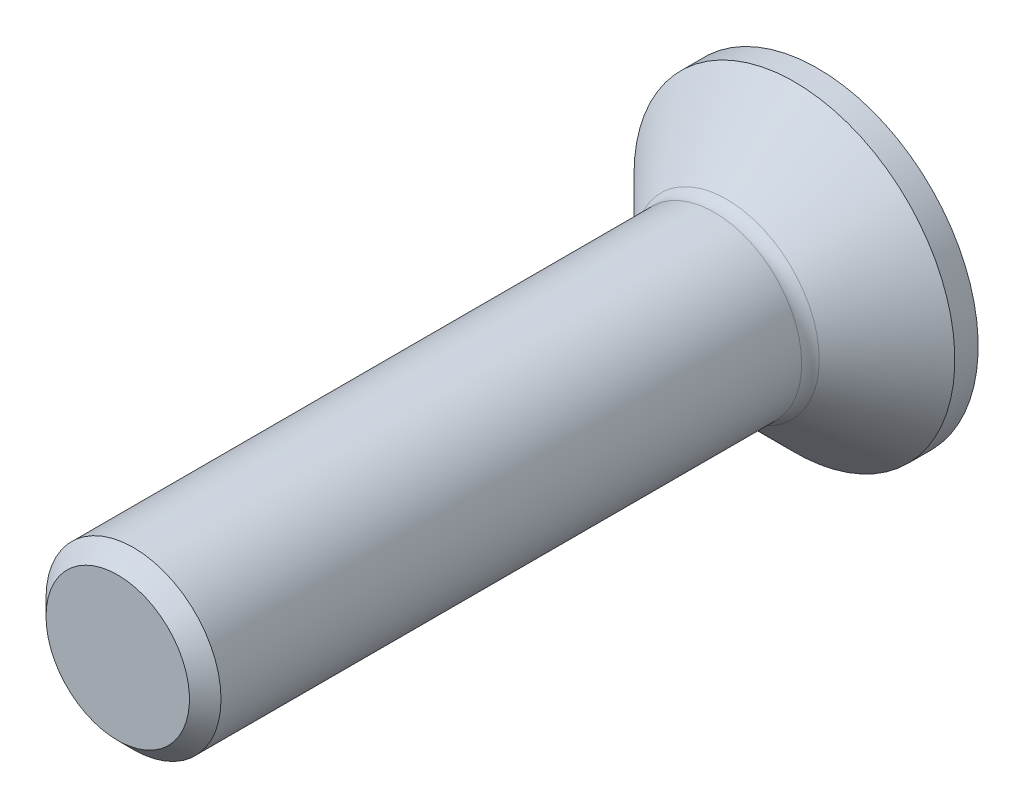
SolidWorks part; units mm, degrees
ref_plane "Plan1" through (0, 0, 0) normal (0, 0, 1) x (1, 0, 0)
ref_plane "Plan2" through (0, 0, 0) normal (0, 1, 0) x (1, 0, 0)
ref_plane "Plan3" through (0, 0, 0) normal (1, 0, 0) x (0, 0, -1)
sketch "Sketch1" plane through (0, 0, 0) normal (1, 0, 0) x (0, 0, -1)
  line L0 (0, 1.5) -> (1.65, 3.15)
  line L1 (1.65, 3.15) -> (1.65, 0)
  line L2 (0, 1.5) -> (-10.35, 1.5)
  line L3 (-10.35, 1.5) -> (-10.35, 0)
  line L4 (-10.35, 0) -> (1.65, 0) construction
  line L5 (-10.35, 0) -> (1.65, 0)
  line L6 (1.65, 0) -> (1.15, 0) construction
  dimension "D2" = 45
  dimension "K" = 1.65
  dimension "L" = 12
  dimension "D" = 3
  dimension "P" = 0.5
revolve "Base-Revolve" add sketch "Sketch1"
chamfer "Chamfer1" distance 0.2706 angle 45 1 edges at (1.5, 0, 10.35)
fillet "Fillet1" radius 0.3 1 edges at (1.5, 0, 0)
sketch "Sketch2" plane through (0, 0, -1.65) normal (0, 0, -1) x (-1, 0, 0)
  circle A0 centre (0, 0) radius 2.75
  circle A1 centre (0, 0) radius 3.15 construction
  dimension "DK" = 5.5
extrude "Cut-Extrude1" cut sketch "Sketch2" against normal through all flip side to cut
hole_wizard "Hole1" positions "Sketch4" profile "Sketch3" legacy
sketch "Sketch4" plane through (0, 0, -1.65) normal (0, 0, -1) x (-1, 0, 0)
  circle A0 centre (0, 0) radius 2.75 construction
  point P0 (0, 0)
sketch "Sketch3" plane through (0, 0, -1.65) normal (1, 0, 0) x (0, 1, 0)
  line L0 (0, 0) -> (0, 1.6274)
  line L1 (0, 1.6274) -> (1, 1.05)
  line L2 (1, 1.05) -> (1, 0)
  line L4 (1, 0) -> (0, 0)
  line L6 (0, 1.6274) -> (-1, 1.05) construction
  line L7 (0, -4.2442) -> (0, 117.3081) construction
  dimension "Diameter" = 2
  dimension "Depth" = 1.05
  dimension "Drill Angle" = 120
sketch "Sketch5" plane through (0, 0, -1.65) normal (0, 0, -1) x (-1, 0, 0)
  line L0 (-1.1547, 0) -> (1.1547, 0) construction
  line L1 (0, 1) -> (0, -1) construction
  line L2 (-0.5774, 1) -> (0.5774, 1)
  line L3 (0.5774, 1) -> (1.1547, 0)
  line L4 (1.1547, 0) -> (0.5774, -1)
  line L5 (0.5774, -1) -> (-0.5774, -1)
  line L6 (-0.5774, -1) -> (-1.1547, 0)
  line L7 (-1.1547, 0) -> (-0.5774, 1)
  circle A0 centre (0, 0) radius 1 construction
  dimension "D1" = 120
extrude "Cut-Extrude2" cut sketch "Sketch5" against normal blind 1.05
equation "\"D2@Cut-Extrude2\" = \"Depth@Sketch3\""
equation "\"D1@Cosmetic_Thread1\" = \"D@Sketch1\"-(1.0825*\"P@Sketch1\")"
equation "\"D1@Chamfer1\" = (\"D@Sketch1\"-\"D1@Cosmetic_Thread1\")/2"
